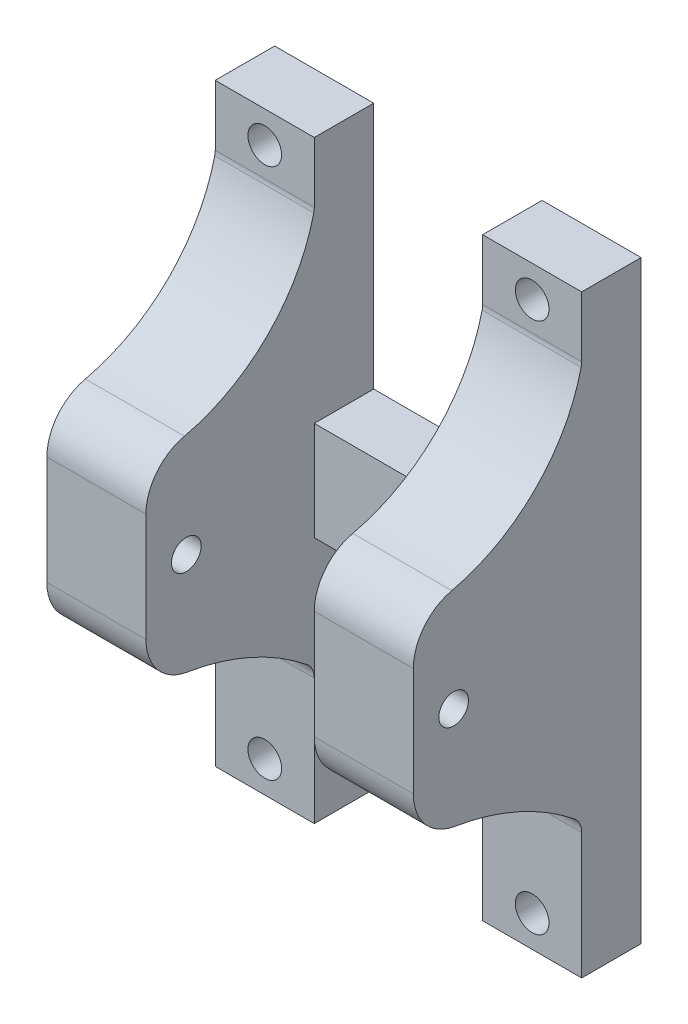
SolidWorks part; units mm, degrees
ref_plane "Front Plane" through (0, 0, 0) normal (0, 0, 1) x (1, 0, 0)
ref_plane "Top Plane" through (0, 0, 0) normal (0, 1, 0) x (1, 0, 0)
ref_plane "Right Plane" through (0, 0, 0) normal (1, 0, 0) x (0, 0, -1)
sketch "Sketch1" plane through (0, 0, 0) normal (0, 0, 1) x (1, 0, 0)
  line L0 (-8.5, -5) -> (-8.5, -30)
  line L1 (-18.5, 30) -> (-8.5, 30)
  line L2 (-18.5, 30) -> (-18.5, -30)
  line L3 (-18.5, -30) -> (-8.5, -30)
  line L4 (-8.5, 30) -> (-8.5, 5)
  line L5 (8.5, 30) -> (18.5, 30)
  line L6 (8.5, 30) -> (8.5, 5)
  line L7 (8.5, -30) -> (18.5, -30)
  line L8 (18.5, 30) -> (18.5, -30)
  line L9 (-8.5, 5) -> (8.5, 5)
  line L11 (-8.5, -5) -> (8.5, -5)
  line L13 (8.5, -5) -> (8.5, -30)
  point P12 (0, 5)
  point P14 (-18.5, 0)
  dimension "D1" = 17
  dimension "D2" = 10
  dimension "D3" = 10
  dimension "D4" = 60
extrude "Boss-Extrude1" add sketch "Sketch1" along normal blind 6
sketch "Sketch3" plane through (-18.5, 0, 0) normal (-1, 0, 0) x (0, 0, 1)
  line L0 (6, 30) -> (6, -30) construction
  line L1 (23, 10) -> (23, -10)
  line L2 (6, 23.6632) -> (6, -16.3368)
  circle A0 centre (18.9262, 0) radius 1.5
  arc A1 (23, 10) -> (6, 23.6632) centre (23, 27.4074) cw
  arc A2 (23, -10) -> (6, -16.3368) centre (23, -35.9718) ccw
  point P10 (23, 0)
  dimension "D3" = 3
  dimension "D1" = 40
  dimension "D2" = 20
  dimension "D4" = 17
extrude "Boss-Extrude2" add sketch "Sketch3" against normal blind 10
sketch "Sketch4" plane through (0, 0, 6) normal (0, 0, 1) x (1, 0, 0)
  line L0 (-8.5, 30) -> (-18.5, 30) construction
  line L1 (-18.5, 30) -> (-18.5, 23.6632) construction
  circle A0 centre (-13.5, 26.8316) radius 1.7
  point P6 (-13.5, 30)
  point P10 (-18.5, 26.8316)
  dimension "D1" = 3.4
extrude "Cut-Extrude1" cut sketch "Sketch4" against normal blind 10
mirror "Mirror2" about plane through (0, 0, 0) normal (1, 0, 0) of "Cut-Extrude1"
mirror "Mirror3" about plane through (0, 0, 0) normal (0, 1, 0) of "Mirror2", "Cut-Extrude1"
mirror "Mirror4" about plane through (0, 0, 0) normal (1, 0, 0) of "Boss-Extrude2"
fillet "Fillet1" radius 5 4 edges at (13.5, 10, 23) (-13.5, 10, 23) (13.5, -10, 23) (-13.5, -10, 23)
fillet "Fillet2" radius 2 4 edges at (13.5, -16.3368, 6) (-13.5, -16.3368, 6) (-13.5, 23.6632, 6) (13.5, 23.6632, 6)
